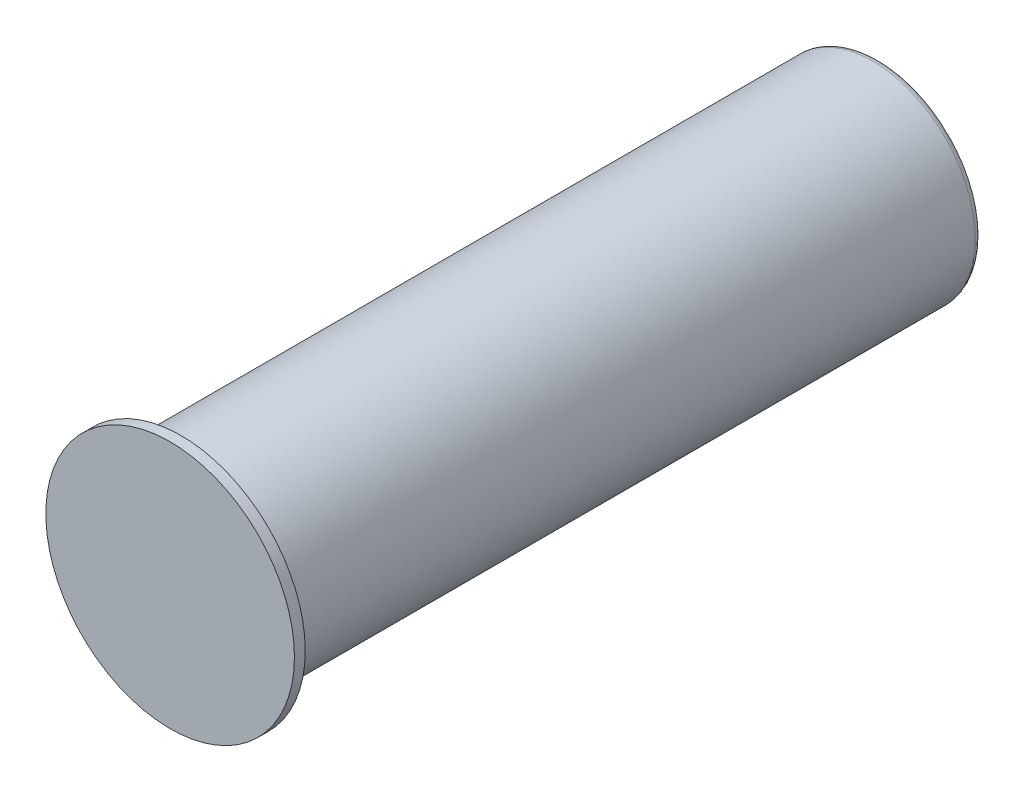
SolidWorks part; units mm, degrees
ref_plane "Front Plane" through (0, 0, 0) normal (0, 0, 1) x (1, 0, 0)
ref_plane "Top Plane" through (0, 0, 0) normal (0, 1, 0) x (1, 0, 0)
ref_plane "Right Plane" through (0, 0, 0) normal (1, 0, 0) x (0, 0, -1)
sketch "Sketch1" plane through (0, 0, 0) normal (1, 0, 0) x (0, 0, -1)
  line L0 (0, 0) -> (35, 0) construction
  line L1 (0, 0) -> (0, 57.5)
  line L2 (0, 57.5) -> (5, 57.5)
  line L3 (5, 57.5) -> (5, 47.5)
  line L4 (5, 47.5) -> (325, 47.5)
  line L5 (328, 44.5) -> (328, 9.5)
  line L6 (326.5, 8) -> (312, 8)
  line L7 (312, 8) -> (307.3812, 0)
  line L8 (326.5, 8) -> (328, 9.5)
  line L9 (0, 0) -> (307.3812, 0)
  arc A0 (325, 47.5) -> (328, 44.5) centre (325, 44.5) cw
  point P13 (328, 47.5)
  dimension "D10" = 3
  dimension "D1" = 47.5
  dimension "D2" = 57.5
  dimension "D3" = 5
  dimension "D4" = 323
  dimension "D5" = 16
  dimension "D6" = 8
  dimension "D7" = 60
  dimension "D8" = 45
  dimension "D9" = 1.5
revolve "Revolve1" add sketch "Sketch1" angle 360 about L0
